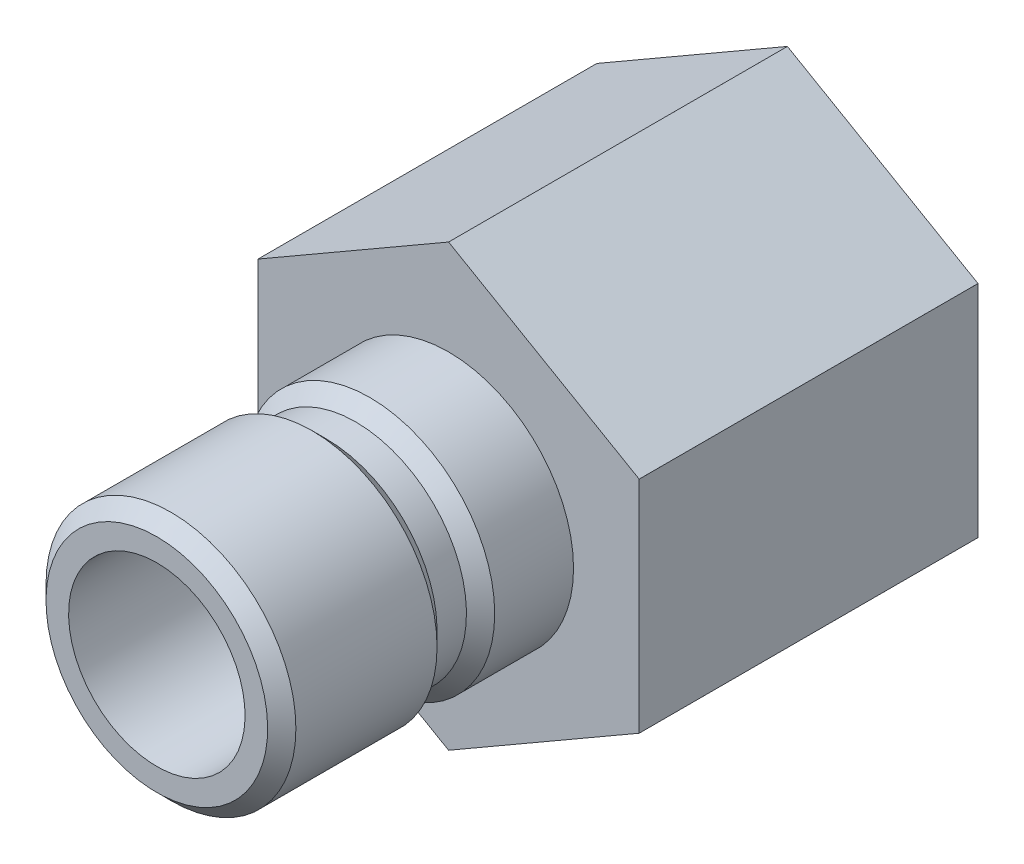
SolidWorks part; units mm, degrees
ref_plane "Front Plane" through (0, 0, 0) normal (0, 0, 1) x (1, 0, 0)
ref_plane "Top Plane" through (0, 0, 0) normal (0, 1, 0) x (1, 0, 0)
ref_plane "Right Plane" through (0, 0, 0) normal (1, 0, 0) x (0, 0, -1)
sketch "Sketch1" plane through (0, 0, 0) normal (1, 0, 0) x (0, 0, -1)
  line L0 (0, 0) -> (-18.923, 0) construction
  line L1 (-15.748, 4.7625) -> (-15.748, 5.9817)
  line L2 (-6.604, 5.9817) -> (-6.604, 0) construction
  line L3 (-14.986, 6.7437) -> (-7.366, 6.7437)
  line L4 (0, 11.8783) -> (0, 0) construction
  line L5 (-6.604, 5.9817) -> (-5.0165, 5.9817)
  line L6 (-4.2545, 6.7437) -> (0, 6.7437)
  line L7 (0, 6.7437) -> (0, 11.8783)
  line L8 (-6.604, 5.9817) -> (-7.366, 6.7437)
  line L9 (-5.0165, 5.9817) -> (-4.2545, 6.7437)
  line L10 (-15.748, 5.9817) -> (-14.986, 6.7437)
  line L11 (-15.748, 4.7625) -> (6.3627, 4.7625)
  line L12 (0, 11.8783) -> (18.288, 11.8783)
  line L13 (6.3627, 4.7625) -> (6.3627, 7.3419)
  line L14 (18.288, 11.8783) -> (18.288, 7.7145)
  line L15 (6.3627, 7.3419) -> (18.288, 7.7145)
  dimension "D1" = 15.748
  dimension "D2" = 1.5875
  dimension "D3" = 0.762
  dimension "D4" = 45
  dimension "D5" = 9.144
  dimension "D6" = 45
  dimension "D7" = 23.7566
  dimension "D8" = 9.525
  dimension "D9" = 34.036
  dimension "D10" = 3.175
  dimension "D11" = 14.6837
  dimension "D12" = 11.9253
  dimension "D13" = 1.79
  dimension "D14" = 13.4874
revolve "Revolve1" add sketch "Sketch1" angle 360 about L0
sketch "Sketch2" plane through (0, 0, 0) normal (0, 0, 1) x (1, 0, 0)
  line L1 (-10.287, 5.9392) -> (-10.287, -5.9392)
  line L2 (-10.287, -5.9392) -> (0, -11.8784)
  line L3 (0, -11.8784) -> (10.287, -5.9392)
  line L4 (10.287, -5.9392) -> (10.287, 5.9392)
  line L5 (10.287, 5.9392) -> (0, 11.8784)
  line L6 (0, 11.8784) -> (-10.287, 5.9392)
  circle A0 centre (0, 0) radius 10.287 construction
  dimension "D1" = 20.574
extrude "Cut-Extrude1" cut sketch "Sketch2" against normal through all flip side to cut
